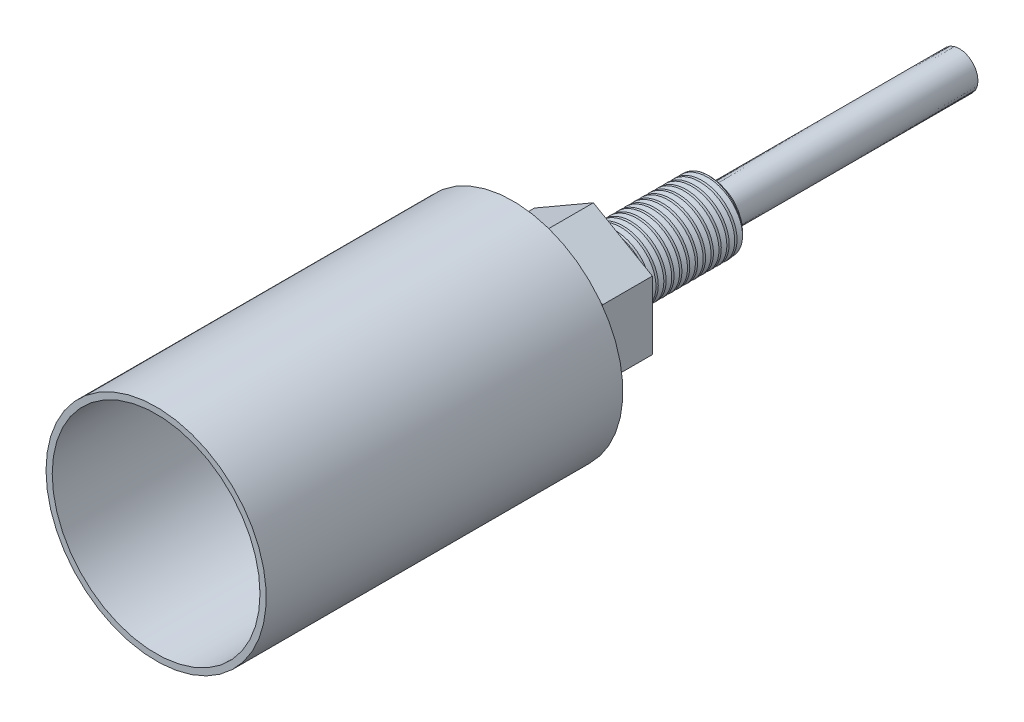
SolidWorks part; units mm, degrees
ref_plane "Front Plane" through (0, 0, 0) normal (0, 0, 1) x (1, 0, 0)
ref_plane "Top Plane" through (0, 0, 0) normal (0, 1, 0) x (1, 0, 0)
ref_plane "Right Plane" through (0, 0, 0) normal (1, 0, 0) x (0, 0, -1)
imported_body "dbh8f.stp"
sketch "Sketch1" plane through (0, 0, -5) normal (0, 0, -1) x (-1, 0, 0)
  circle A0 centre (0, 0) radius 17.75
  circle A1 centre (0, 0) radius 16.75
  dimension "D1" = 35.5
  dimension "D2" = 33.5
extrude "Boss-Extrude1" add sketch "Sketch1" against normal blind 57.5 separate body
